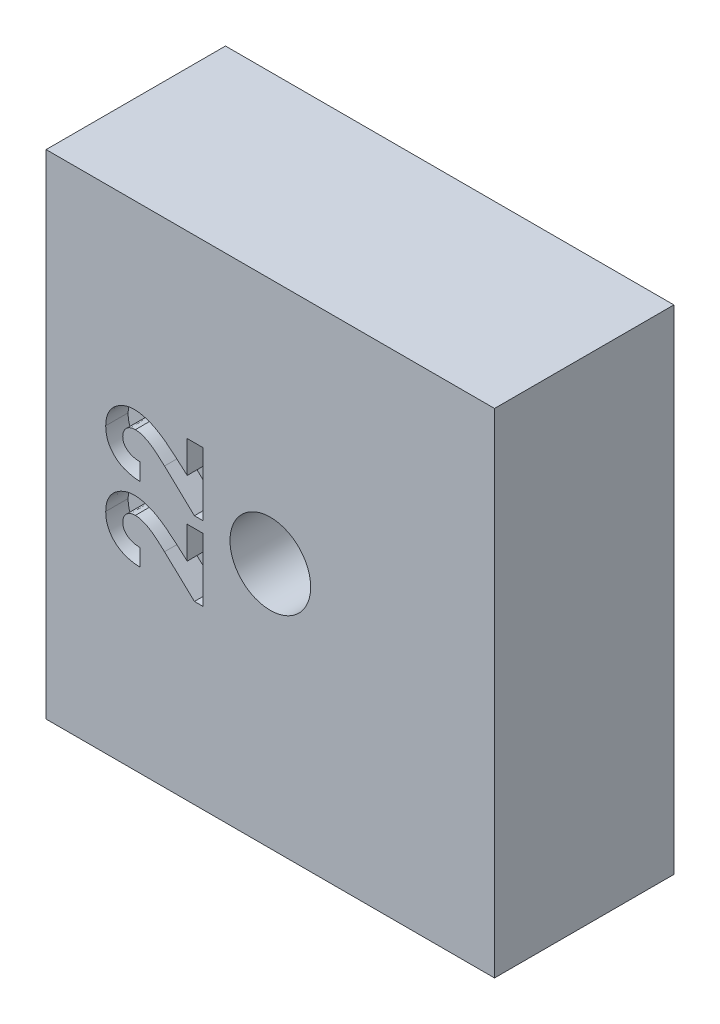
SolidWorks part; units mm, degrees
ref_plane "Front Plane" through (0, 0, 0) normal (0, 0, 1) x (1, 0, 0)
ref_plane "Top Plane" through (0, 0, 0) normal (0, 1, 0) x (1, 0, 0)
ref_plane "Right Plane" through (0, 0, 0) normal (1, 0, 0) x (0, 0, -1)
sketch "Sketch1" plane through (0, 0, 0) normal (0, 0, 1) x (1, 0, 0)
  line L1 (-12.2454, 15.0291) -> (7.7546, 15.0291)
  line L2 (-12.2454, 15.0291) -> (-12.2454, -6.9709)
  line L3 (-12.2454, -6.9709) -> (7.7546, -6.9709)
  line L4 (7.7546, 15.0291) -> (7.7546, -6.9709)
  circle A0 centre (-2.2454, 4.0291) radius 1.8
  point P6 (-12.2454, 4.0291)
  dimension "D3" = 3.6
  dimension "D1" = 22
  dimension "D2" = 20
  dimension "D4" = 10
extrude "Boss-Extrude1" add sketch "Sketch1" along normal blind 8
ref_plane "Plane1" through (0, 0, 8) normal (0, 0, 1) x (1, 0, 0)
sketch "Sketch3" plane through (0, 0, 8) normal (0, 0, 1) x (1, 0, 0)
  line L0 (-5.2454, -6.9709) -> (-5.2454, 15.0291) construction
  line L1 (-12.2454, -6.9709) -> (7.7546, -6.9709) construction
  line L2 (7.7546, 15.0291) -> (-12.2454, 15.0291) construction
  line L3 (7.7546, -6.9709) -> (7.7546, 15.0291) construction
  text T0 "22" font "Century Gothic" height in points 16
  dimension "D1" = 13
extrude "Cut-Extrude1" cut sketch "Sketch3" against normal blind 1
